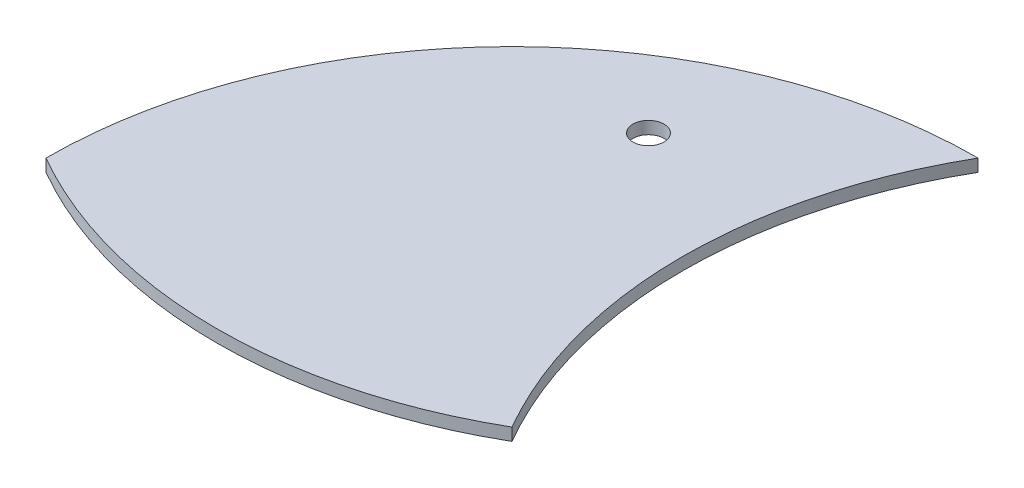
SolidWorks part; units mm, degrees
ref_plane "Front" through (0, 0, 0) normal (0, 0, 1) x (1, 0, 0)
ref_plane "Top" through (0, 0, 0) normal (0, 1, 0) x (1, 0, 0)
ref_plane "Right" through (0, 0, 0) normal (1, 0, 0) x (0, 0, -1)
sketch "Sketch1" plane through (0, 0, 0) normal (0, 1, 0) x (1, 0, 0)
  line L0 (0, 37.5) -> (0, -37.5) construction
  line L1 (-37.5, 0) -> (37.5, 0) construction
  line L2 (0, 0) -> (-15, 25.9808) construction
  circle A0 centre (0, 0) radius 30 construction
  circle A1 centre (0, 0) radius 37.5
  arc A2 (-37.5, 0) -> (0, 0) centre (-18.75, 32.476) ccw
  arc A3 (0, 37.5) -> (0, 0) centre (32.476, 18.75) ccw
  arc A4 (37.5, 0) -> (0, 0) centre (18.75, -32.476) ccw
  arc A5 (0, -37.5) -> (0, 0) centre (-32.476, -18.75) ccw
  circle A6 centre (-15, 25.9808) radius 1.25
  circle A7 centre (0, 0) radius 27.5 construction
  point P18 (0, 0)
  dimension "D1" = 60
  dimension "D2" = 75
  dimension "D3" = 4
  dimension "D4" = 2.5
  dimension "D5" = 55
extrude "Boss-Extrude1" add sketch "Sketch1" along normal blind 1
